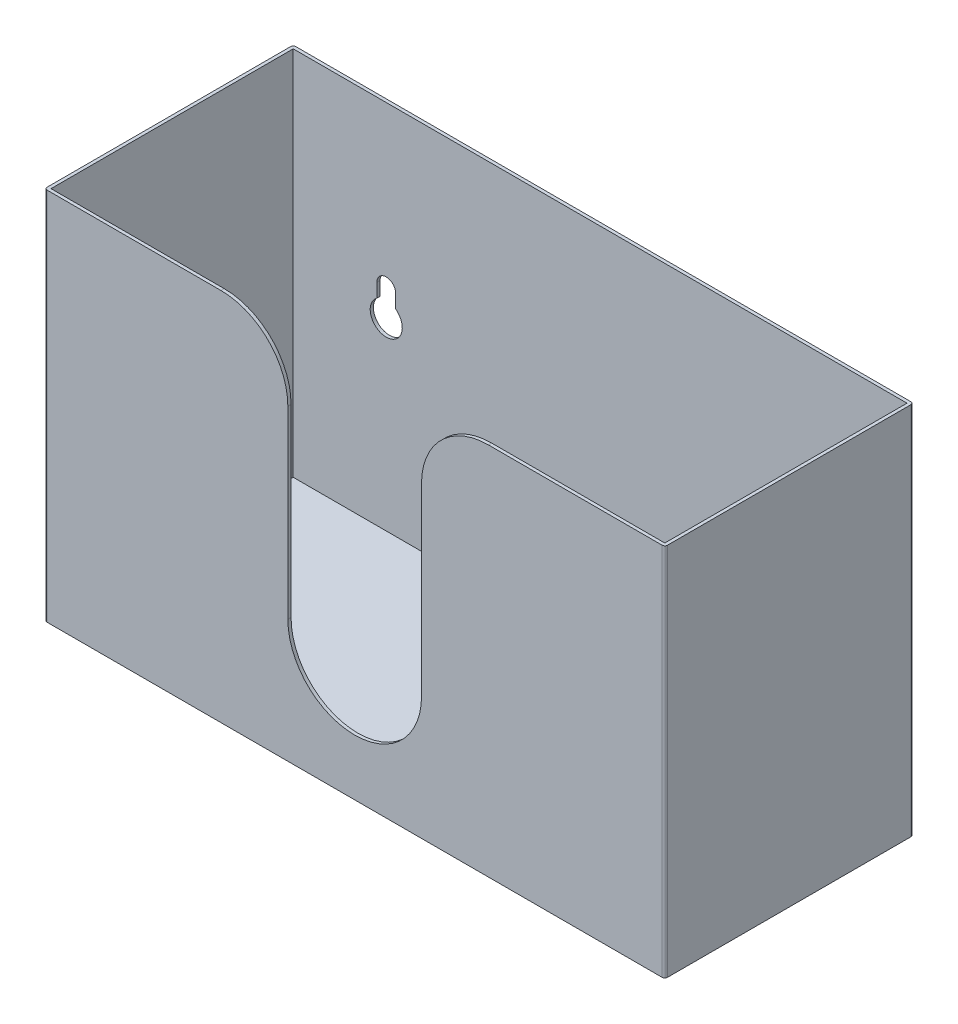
SolidWorks part; units mm, degrees
ref_plane "Front Plane" through (0, 0, 0) normal (0, 0, 1) x (1, 0, 0)
ref_plane "Top Plane" through (0, 0, 0) normal (0, 1, 0) x (1, 0, 0)
ref_plane "Right Plane" through (0, 0, 0) normal (1, 0, 0) x (0, 0, -1)
sketch "Sketch1" plane through (0, 0, 0) normal (0, 1, 0) x (1, 0, 0)
  line L1 (116, -46.5) -> (-116, -46.5)
  line L2 (116, -46.5) -> (116, 46.5)
  line L3 (116, 46.5) -> (-116, 46.5)
  line L4 (-116, -46.5) -> (-116, 46.5)
  line L5 (116, -46.5) -> (-116, 46.5) construction
  line L6 (116, 46.5) -> (-116, -46.5) construction
  point P0 (0, 0)
  dimension "D1" = 232
  dimension "D2" = 93
extrude "Boss-Extrude1" add sketch "Sketch1" along normal blind 140
fillet "Fillet1" radius 1 4 edges at (-116, 70, -46.5) (116, 70, -46.5) (116, 70, 46.5) (-116, 70, 46.5)
shell "Shell1" thickness 1.2
sketch "Sketch2" plane through (0, 0, 46.5) normal (0, 0, 1) x (1, 0, 0)
  line L0 (0, 234) -> (0, 46) construction
  line L1 (-115, 140) -> (115, 140) construction
  line L2 (25, 234) -> (25, 46)
  line L3 (-25, 234) -> (-25, 46)
  arc A0 (25, 234) -> (-25, 234) centre (0, 234) ccw
  arc A1 (-25, 46) -> (25, 46) centre (0, 46) ccw
  point P5 (0, 140)
  dimension "D1" = 25
  dimension "D2" = 94
extrude "Cut-Extrude1" cut sketch "Sketch2" against normal blind 10
fillet "Fillet2" radius 25 2 edges at (25, 140, 45.9) (-25, 140, 45.9)
sketch "Sketch3" plane through (0, 0, -46.5) normal (0, 0, -1) x (-1, 0, 0)
  line L0 (-80, 70) -> (-80, 80) construction
  line L1 (-83.5, 70) -> (-83.5, 80)
  line L2 (-76.5, 70) -> (-76.5, 80)
  line L4 (-116, 70) -> (116, 70) construction
  line L5 (-116, 0) -> (-116, 140) construction
  line L6 (116, 140) -> (116, 0) construction
  line L8 (0, 55) -> (0, -55) construction
  line L11 (80, 70) -> (80, 80) construction
  line L12 (83.5, 70) -> (83.5, 80)
  line L13 (76.5, 70) -> (76.5, 80)
  circle A3 centre (-80, 70) radius 6
  arc A4 (-83.5, 70) -> (-76.5, 70) centre (-80, 70) ccw
  arc A5 (-76.5, 80) -> (-83.5, 80) centre (-80, 80) ccw
  circle A9 centre (80, 70) radius 6
  arc A10 (83.5, 70) -> (76.5, 70) centre (80, 70) cw
  arc A11 (76.5, 80) -> (83.5, 80) centre (80, 80) cw
  point P4 (-80, 75)
  point P21 (80, 75)
  dimension "D1" = 12
  dimension "D2" = 3.5
  dimension "D3" = 10
  dimension "D4" = 80
extrude "Cut-Extrude2" cut sketch "Sketch3" against normal blind 10 contours A4 L1 A3 L2 | L1 A4 L2 A3 | L2 A5 L1 A3 | L12 A10 L13 A9 | A10 L12 A9 L13 | A11 L13 A9 L12
